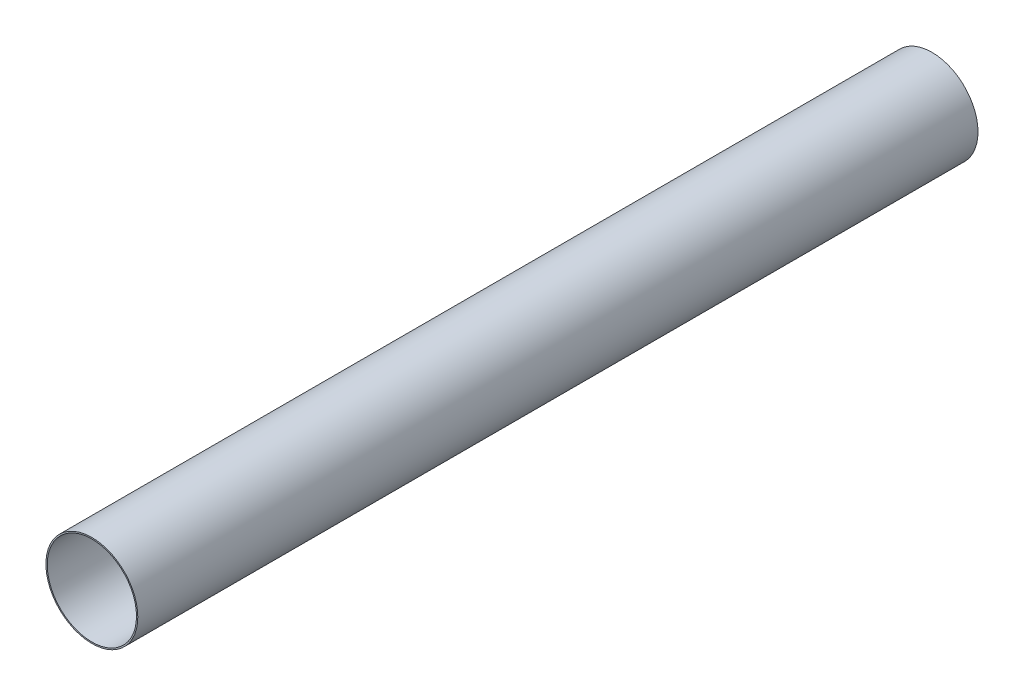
SolidWorks part; units mm, degrees
ref_plane "Front Plane" through (0, 0, 0) normal (0, 0, 1) x (1, 0, 0)
ref_plane "Top Plane" through (0, 0, 0) normal (0, 1, 0) x (1, 0, 0)
ref_plane "Right Plane" through (0, 0, 0) normal (1, 0, 0) x (0, 0, -1)
sketch "Sketch1" plane through (0, 0, 0) normal (0, 0, 1) x (1, 0, 0)
  circle A0 centre (0, 0) radius 27.7813
  circle A1 centre (0, 0) radius 26.9875
  dimension "D1" = 53.975
  dimension "D2" = 55.5625
extrude "Extrude1" add sketch "Sketch1" along normal blind 508
